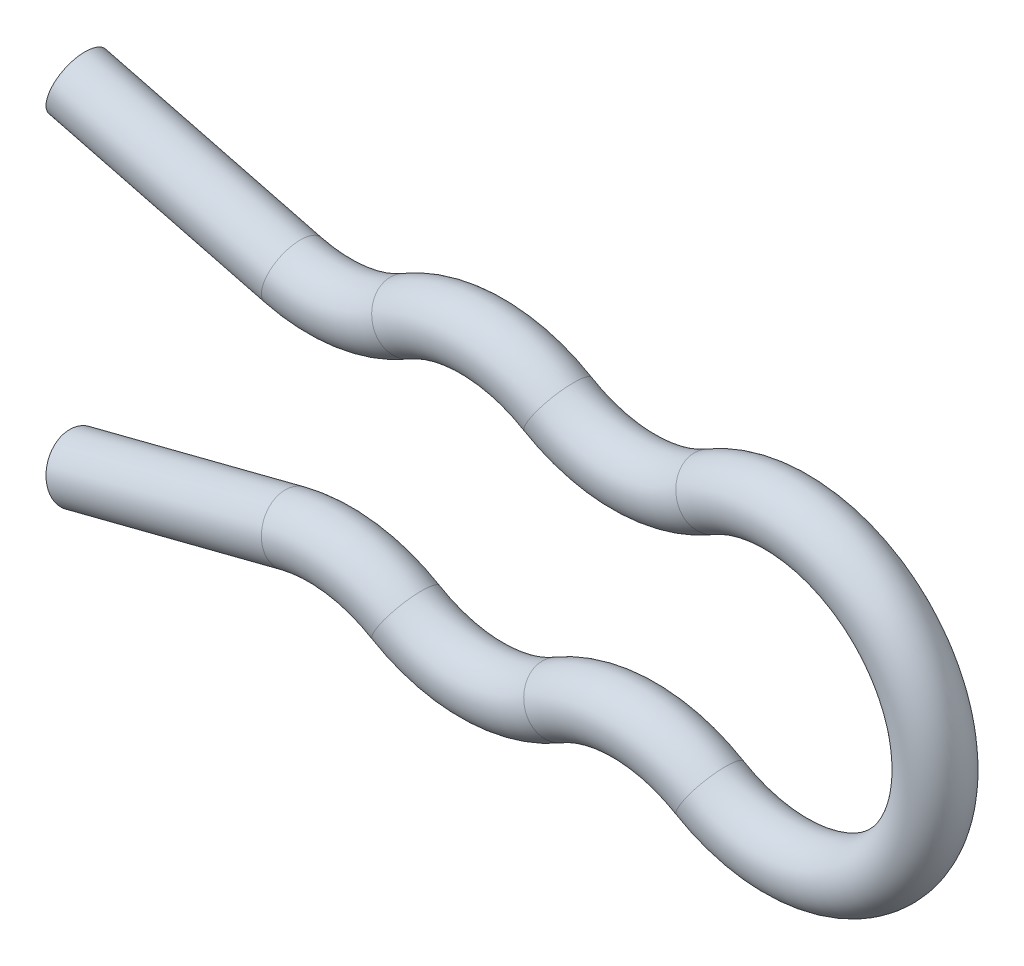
SolidWorks part; units mm, degrees
ref_plane "Plan de face" through (0, 0, 0) normal (0, 0, 1) x (1, 0, 0)
ref_plane "Plan de dessus" through (0, 0, 0) normal (0, 1, 0) x (1, 0, 0)
ref_plane "Plan de droite" through (0, 0, 0) normal (1, 0, 0) x (0, 0, -1)
sketch "Esquisse1" plane through (0, 0, 0) normal (0, 0, 1) x (1, 0, 0)
  line L0 (-13.4412, 0) -> (4.6599, 0) construction
  line L1 (-8.1091, 1.8412) -> (-11.65, 2.75)
  arc A0 (2.45, 0) -> (-1.25, 2.1071) centre (0, 0) ccw
  arc A1 (-3.75, 2.1071) -> (-6.25, 2.1071) centre (-5, 0) ccw
  arc A2 (-3.75, 2.1071) -> (-1.25, 2.1071) centre (-2.5, 4.2143) ccw
  arc A3 (-8.1091, 1.8412) -> (-6.25, 2.1071) centre (-7.5, 4.2143) ccw
  point P13 (2.45, 0)
  dimension "D1" = 4.9
  dimension "D2" = 4.9
  dimension "D4" = 4.9
  dimension "D6" = 4.9
  dimension "D3" = 5
  dimension "D5" = 2.5
  dimension "D7" = 5
  dimension "D8" = 5.5
  dimension "D9" = 14.1
sketch "Esquisse2" plane through (0, 0, 0) normal (0, 1, 0) x (1, 0, 0)
  circle A0 centre (2.45, 0) radius 0.5
  dimension "D1" = 1
sweep "Balayage1" add profiles "Esquisse2" path "Esquisse1"
mirror "Symétrie1" about plane through (2.45, 0, 0) normal (0, 1, 0) of "Balayage1"
sketch "Esquisse3" plane through (0, 0, 0) normal (1, 0, 0) x (0, 0, -1)
  line L1 (0.7579, 3.314) -> (0.499, 3.314)
  line L2 (0.7579, 3.314) -> (0.7579, -3.3865)
  line L3 (0.7579, -3.3865) -> (0.499, -3.3865)
  line L4 (0.499, 3.314) -> (0.499, -3.3865)
  dimension "D1" = 0.499
extrude "Enlèv. mat.-Extru.1" cut sketch "Esquisse3" against normal mid plane 60
